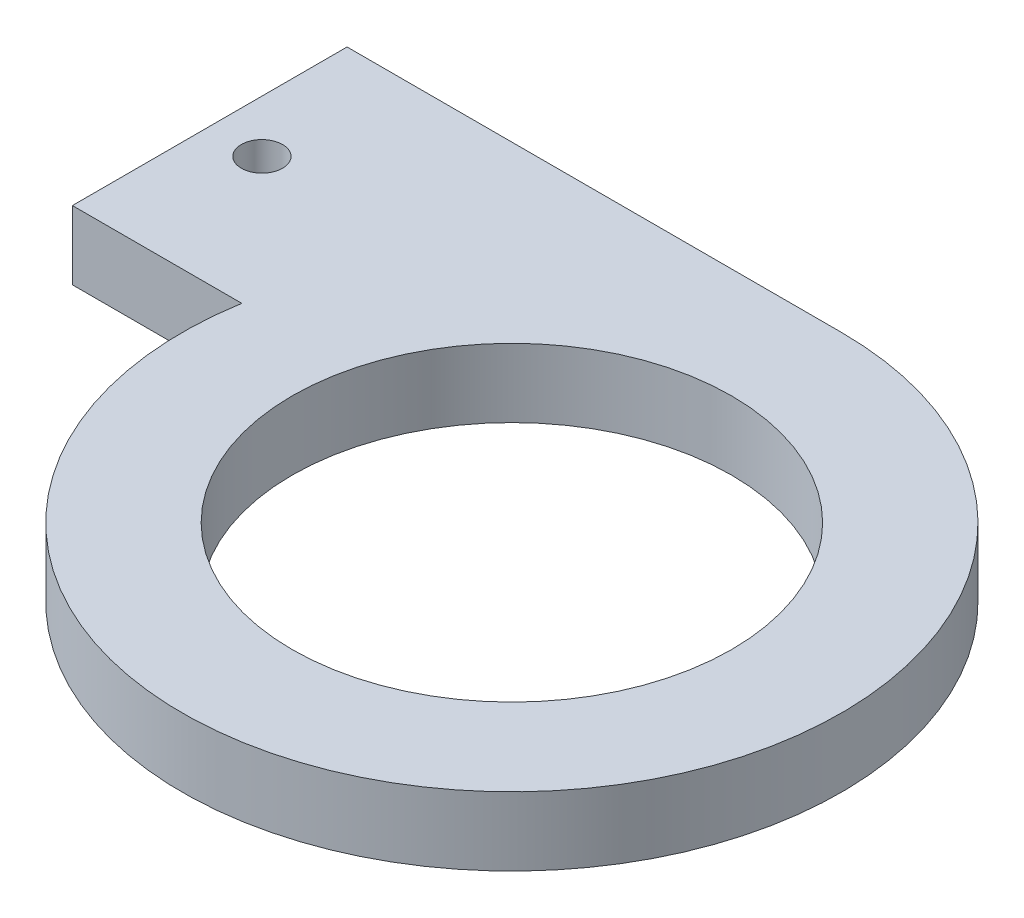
SolidWorks part; units mm, degrees
ref_plane "Front Plane" through (0, 0, 0) normal (0, 0, 1) x (1, 0, 0)
ref_plane "Top Plane" through (0, 0, 0) normal (0, 1, 0) x (1, 0, 0)
ref_plane "Right Plane" through (0, 0, 0) normal (1, 0, 0) x (0, 0, -1)
sketch "Sketch2" plane through (0, 0, 0) normal (0, 1, 0) x (1, 0, 0)
  line L0 (0, 24) -> (-36, 24)
  line L1 (-36, 24) -> (-36, 4)
  line L2 (-36, 4) -> (-23.6643, 4)
  circle A0 centre (0, 0) radius 24
  circle A1 centre (0, 0) radius 16
  circle A2 centre (-32.2, 14) radius 1.5
extrude "Boss-Extrude1" add sketch "Sketch2" along normal blind 5 contours A0 L0 L1 L2 A2 | A0 A1
